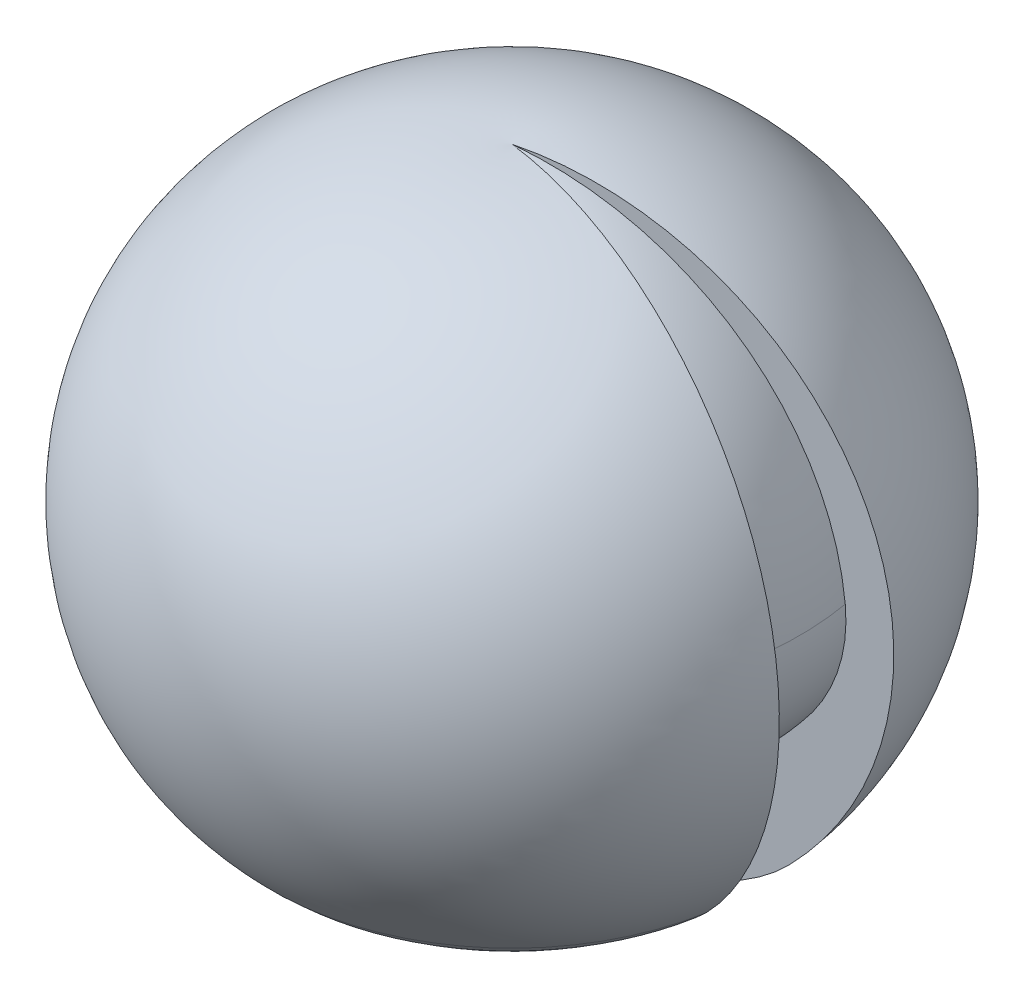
SolidWorks part; units mm, degrees
ref_plane "Front" through (0, 0, 0) normal (0, 0, 1) x (1, 0, 0)
ref_plane "Top" through (0, 0, 0) normal (0, 1, 0) x (1, 0, 0)
ref_plane "Right" through (0, 0, 0) normal (1, 0, 0) x (0, 0, -1)
sketch "Sketch1" plane through (0, 0, 0) normal (0, 0, 1) x (1, 0, 0)
  line L0 (0, 0) -> (0, 365) construction
  line L1 (0, 365) -> (-50, 365) construction
  line L2 (-50, 365) -> (-50, 735) construction
  line L3 (-50, 735) -> (-50, 785) construction
  line L4 (-50, 785) -> (-435.9447, 785) construction
  line L5 (-435.9447, 785) -> (-50, 735) construction
  line L6 (-50, 735) -> (0, 735) construction
  dimension "D1" = 365
  dimension "D2" = 370
  dimension "D3" = 50
  dimension "D4" = 50
  dimension "D5" = 389.17
  dimension "D6" = 90
  dimension "D7" = 785
  dimension "D8" = 435.9447
sketch "Sketch2" plane through (0, 0, 0) normal (0, 0, 1) x (1, 0, 0)
  line L0 (0, 0) -> (0, 365) construction
  line L1 (0, 365) -> (-50, 365) construction
  line L2 (-50, 365) -> (-311.6295, 103.3705) construction
  line L3 (-311.6295, 103.3705) -> (-358.4294, 85.7702) construction
  line L4 (-358.4294, 85.7702) -> (-222.575, -275.4732) construction
  line L5 (-222.575, -275.4732) -> (-311.6295, 103.3705) construction
  line L6 (-50, 365) -> (-50, 735) construction
  line L7 (-50, 735) -> (-50, 785) construction
  line L8 (-435.9447, 785) -> (-50, 735) construction
  line L9 (-311.6295, 103.3705) -> (-346.9848, 138.7258) construction
  dimension "D1" = 135
  dimension "D2" = 65.61
sketch "Sketch3" plane through (0, 0, 0) normal (0, 0, 1) x (1, 0, 0)
  line L0 (0, 0) -> (0, 365) construction
  line L1 (0, 365) -> (-50, 365) construction
  line L2 (-50, 365) -> (-311.6295, 103.3705) construction
  line L3 (-311.6295, 103.3705) -> (-351.2342, 133.8904) construction
  line L4 (-351.2342, 133.8904) -> (-586.8143, -171.8143) construction
  line L5 (-586.8143, -171.8143) -> (-311.6295, 103.3705) construction
  line L6 (-50, 365) -> (-50, 735) construction
  line L7 (-435.9447, 785) -> (-50, 735) construction
  line L8 (-50, 735) -> (-50, 785) construction
  line L9 (-311.6295, 103.3705) -> (-346.9848, 138.7258) construction
  dimension "D1" = 135
  dimension "D2" = 7.382
sketch "Sketch4" plane through (0, 0, 0) normal (0, 0, 1) x (1, 0, 0)
  line L0 (0, 0) -> (0, 365) construction
  line L1 (0, 365) -> (-50, 365) construction
  line L2 (-50, 365) -> (318.592, 397.2476) construction
  line L3 (318.592, 397.2476) -> (329.3132, 348.4106) construction
  line L4 (329.3132, 348.4106) -> (706.2811, 431.166) construction
  line L5 (706.2811, 431.166) -> (318.592, 397.2476) construction
  line L6 (318.592, 397.2476) -> (322.9498, 347.4379) construction
  line L7 (-50, 365) -> (-50, 735) construction
  line L8 (-50, 735) -> (-50, 785) construction
  line L9 (-435.9447, 785) -> (-50, 735) construction
  dimension "D1" = 7.382
  dimension "D2" = 85
sketch "Sketch8" plane through (0, 0, 0) normal (0, 0, 1) x (1, 0, 0)
  line L0 (0, 0) -> (0, 365) construction
  line L1 (0, 365) -> (-50, 365) construction
  line L2 (-50, 365) -> (318.592, 397.2476) construction
  line L3 (318.592, 397.2476) -> (335.693, 444.2323) construction
  line L4 (335.693, 444.2323) -> (-26.9763, 576.2331) construction
  line L5 (-26.9763, 576.2331) -> (318.592, 397.2476) construction
  line L6 (318.592, 397.2476) -> (322.9498, 347.4379) construction
  line L7 (-50, 735) -> (-50, 785) construction
  line L8 (-50, 365) -> (-50, 735) construction
  line L9 (-435.9447, 785) -> (-50, 735) construction
  dimension "D1" = 85
  dimension "D2" = 155
sketch "Sketch9" plane through (0, 0, 0) normal (0, 0, 1) x (1, 0, 0)
  line L0 (0, 0) -> (0, 365) construction
  line L1 (0, 0) -> (0, 365) construction
  line L2 (0, 365) -> (-50, 365) construction
  line L3 (-50, 365) -> (318.592, 397.2476) construction
  line L4 (318.592, 397.2476) -> (365.6469, 414.1544) construction
  line L5 (365.6469, 414.1544) -> (235.145, 777.3659) construction
  line L6 (235.145, 777.3659) -> (318.592, 397.2476) construction
  line L7 (318.592, 397.2476) -> (322.9498, 347.4379) construction
  line L8 (-50, 365) -> (-149.9568, 721.2424) construction
  line L9 (-149.9568, 721.2424) -> (-136.4492, 673.1015) construction
  line L10 (-136.4492, 673.1015) -> (235.145, 777.3659) construction
  line L11 (235.145, 777.3659) -> (-149.9568, 721.2424) construction
  line L12 (-149.9568, 721.2424) -> (-101.816, 734.7501) construction
  line L13 (-50, 735) -> (-50, 785) construction
  line L14 (-435.9447, 785) -> (-50, 735) construction
  line L17 (-50, 365) -> (-50, 735) construction
  dimension "D1" = 90
  dimension "D2" = 15.673
  dimension "D3" = 85
  dimension "D4" = 104.763
sketch "Sketch5" plane through (0, 0, 0) normal (0, 0, 1) x (1, 0, 0)
  line L1 (-180, 196.9241) -> (-180, -262.863)
  line L7 (302.4, 8.3944) -> (302.4, 8.4146)
  line L8 (0, 0) -> (957.9591, 0) construction
  line L9 (0, 0) -> (0, 265) construction
  arc A6 (68.1409, 188.3867) -> (-180, -262.863) centre (-311.6295, 103.3705) cw construction
  arc A7 (-586.8143, -171.8143) -> (706.2811, 431.166) centre (-50, 365) cw
  arc A8 (68.1409, 188.3867) -> (-180, 196.9241) centre (-50, 365) cw construction
  arc A9 (706.2811, 431.166) -> (302.4, 8.4146) centre (318.592, 397.2476) cw
  arc A10 (302.4, 8.3944) -> (235.145, 777.3659) centre (-50, 365) ccw
  arc A11 (-26.9763, 576.2331) -> (235.145, 777.3659) centre (318.592, 397.2476) cw
  arc A12 (-180, -262.863) -> (-586.8143, -171.8143) centre (-311.6295, 103.3705) cw
  arc A13 (-180, 196.9241) -> (-26.9763, 576.2331) centre (-50, 365) cw
  arc A14 (302.4, 8.3944) -> (302.4196, 8.4138) centre (-50, 365) cw construction
  arc A15 (302.4, 8.4146) -> (302.4196, 8.4138) centre (318.592, 397.2476) cw construction
  point P48 (-809.17, 365)
  point P50 (709.17, 365)
  point P51 (-50, 1124.17)
  point P52 (-311.6295, -285.7995)
  dimension "D5" = 1409.9695
sketch "Sketch10" plane through (0, 0, 0) normal (0, 0, 1) x (1, 0, 0)
  line L1 (0, 620.748) -> (0, 1122.5217)
  line L2 (-180, 196.9241) -> (-180, -262.863) construction
  line L4 (-180, 196.9241) -> (-180, -262.863)
  arc A0 (-586.8143, -171.8143) -> (-180, -262.863) centre (-311.6295, 103.3705) ccw construction
  arc A1 (-586.8143, -171.8143) -> (-180, -262.863) centre (-311.6295, 103.3705) ccw
  arc A2 (-26.9763, 576.2331) -> (-180, 196.9241) centre (-50, 365) ccw construction
  arc A3 (706.2811, 431.166) -> (-586.8143, -171.8143) centre (-50, 365) ccw construction
  arc A4 (-26.9763, 576.2331) -> (-180, 196.9241) centre (-50, 365) ccw
  arc A5 (0, 1122.5217) -> (-586.8143, -171.8143) centre (-50, 365) ccw
  arc A6 (235.145, 777.3659) -> (-26.9763, 576.2331) centre (318.592, 397.2476) ccw construction
  arc A7 (0, 620.748) -> (-26.9763, 576.2331) centre (318.592, 397.2476) ccw
revolve "Revolve1" add sketch "Sketch10" angle 340 mid plane about L1
sketch "Sketch11" plane through (0, 0, 0) normal (0, 0, 1) x (1, 0, 0)
  line L1 (0, 620.748) -> (0, 1122.5217)
  arc A1 (235.145, 777.3659) -> (-26.9763, 576.2331) centre (318.592, 397.2476) ccw construction
  arc A7 (302.4, 8.3944) -> (235.145, 777.3659) centre (-50, 365) ccw construction
  arc A8 (302.4, 8.4146) -> (706.2811, 431.166) centre (318.592, 397.2476) ccw construction
  arc A9 (706.2811, 431.166) -> (-586.8143, -171.8143) centre (-50, 365) ccw construction
  arc A10 (235.145, 777.3659) -> (0, 620.748) centre (318.592, 397.2476) ccw
  arc A11 (302.4196, 8.4138) -> (235.145, 777.3659) centre (-50, 365) ccw
  arc A12 (302.4196, 8.4138) -> (706.2811, 431.166) centre (318.592, 397.2476) ccw
  arc A13 (706.2811, 431.166) -> (0, 1122.5217) centre (-50, 365) ccw
revolve "Revolve2" add sketch "Sketch11" angle 340 mid plane about L1
